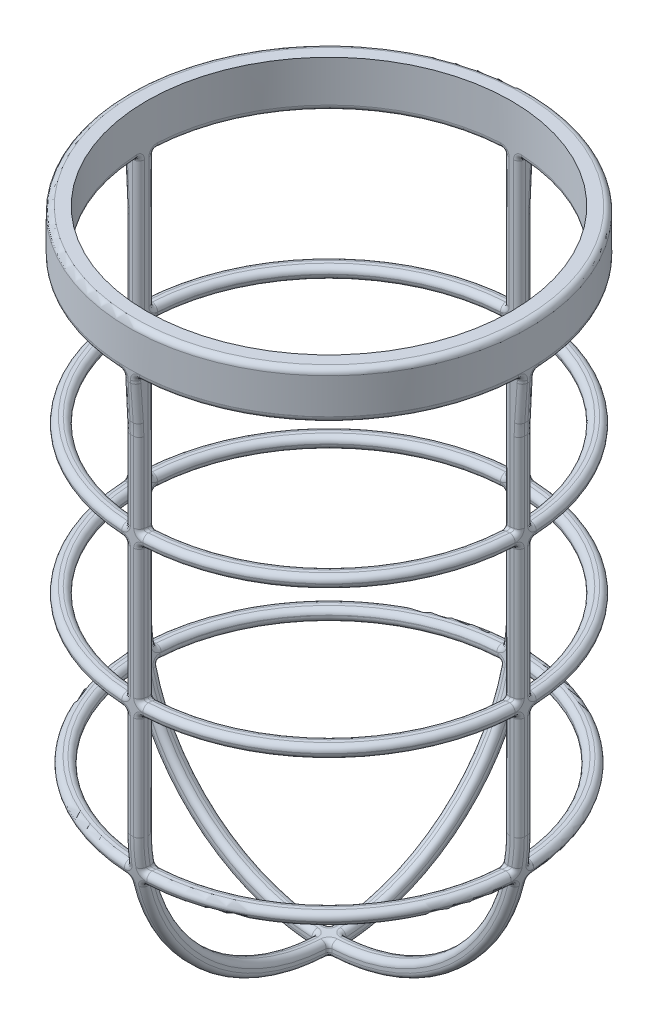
SolidWorks part; units mm, degrees
ref_plane "Front" through (0, 0, 0) normal (0, 0, 1) x (1, 0, 0)
ref_plane "Top" through (0, 0, 0) normal (0, 1, 0) x (1, 0, 0)
ref_plane "Right" through (0, 0, 0) normal (1, 0, 0) x (0, 0, -1)
sketch "Sketch1" plane through (0, 0, 0) normal (0, 0, 1) x (1, 0, 0)
  line L0 (-49.2125, -63.5) -> (-49.2125, -184.15)
  line L1 (0, -233.3625) -> (18.9057, -233.3625) construction
  line L2 (0, 0) -> (0, -237.3312) construction
  line L3 (-49.2125, -63.5) -> (-49.2125, -76.2) construction
  line L4 (-49.2125, -63.5) -> (-53.975, -63.5)
  line L5 (49.2125, -63.5) -> (-49.2125, -63.5) construction
  line L6 (-53.975, -63.5) -> (-53.975, -76.2)
  line L7 (-53.975, -76.2) -> (-53.1812, -88.9)
  line L8 (-53.1812, -88.9) -> (-53.1812, -184.15)
  line L9 (0, -237.3312) -> (18.9057, -237.3312) construction
  line L10 (-49.2125, -76.2) -> (49.2125, -76.2) construction
  line L11 (0, -233.3625) -> (0, -237.3312)
  arc A0 (-49.2125, -184.15) -> (0, -233.3625) centre (0, -184.15) ccw
  arc A1 (-46.0375, -184.15) -> (46.0375, -184.15) centre (0, -184.15) ccw construction
  arc A2 (-53.1812, -184.15) -> (0, -237.3312) centre (0, -184.15) ccw
  dimension "D1" = 3.9688
  dimension "D2" = 4.7625
  dimension "D3" = 12.7
revolve "Revolve1" add sketch "Sketch1" angle 360 about L2
ref_plane "Plane1" through (0, -76.2, 0) normal (0, 1, 0) x (-1, 0, 0)
fillet "Fillet1" radius 50.8 2 edges at (-53.1812, -88.9, 0) (-53.975, -76.2, 0)
sketch "Sketch2" plane through (0, -76.2, 0) normal (0, 1, 0) x (-1, 0, 0)
  line L0 (0, 0) -> (63.5, 0) construction
  line L1 (0, 0) -> (0, -63.5) construction
  line L2 (1.5875, 53.9516) -> (6.2041, 27.7696)
  line L3 (6.2041, 27.7696) -> (1.5875, 1.5875)
  line L4 (1.5875, 1.5875) -> (27.7696, 6.2041)
  line L5 (27.7696, 6.2041) -> (53.9516, 1.5875)
  line L6 (-1.5875, -53.9516) -> (-6.2041, -27.7696)
  line L7 (-1.5875, 53.9516) -> (-6.2041, 27.7696)
  line L8 (-6.2041, 27.7696) -> (-1.5875, 1.5875)
  line L9 (-27.7696, -6.2041) -> (-53.9516, -1.5875)
  line L10 (1.5875, -53.9516) -> (6.2041, -27.7696)
  line L11 (6.2041, -27.7696) -> (1.5875, -1.5875)
  line L12 (1.5875, -1.5875) -> (27.7696, -6.2041)
  line L13 (27.7696, -6.2041) -> (53.9516, -1.5875)
  line L14 (-1.5875, -1.5875) -> (-27.7696, -6.2041)
  line L15 (-6.2041, -27.7696) -> (-1.5875, -1.5875)
  line L16 (-27.7696, 6.2041) -> (-53.9516, 1.5875)
  line L17 (-1.5875, 1.5875) -> (-27.7696, 6.2041)
  circle A0 centre (0, 0) radius 53.975 construction
  arc A1 (1.5875, -53.9516) -> (53.9516, -1.5875) centre (0, 0) ccw
  arc A2 (1.5875, 53.9516) -> (53.9516, 1.5875) centre (0, 0) cw
  arc A3 (-1.5875, 53.9516) -> (-53.9516, 1.5875) centre (0, 0) ccw
  arc A4 (-1.5875, -53.9516) -> (-53.9516, -1.5875) centre (0, 0) cw
  dimension "D1" = 3.175
  dimension "D2" = 10
extrude "Cut-Extrude1" cut sketch "Sketch2" against normal blind 36.5125
pattern_linear "LPattern1" count 4 spacing 39.6875 along (0, -1, 0) of "Cut-Extrude1"
sketch "Sketch3" plane through (0, -195.2625, 0) normal (0, -1, 0) x (1, 0, 0)
  line L0 (-1.9367, 51.9712) -> (-1.9367, 1.9367)
  line L1 (-51.9712, 1.9367) -> (-1.9367, 1.9367)
  line L4 (-1.9367, -51.9712) -> (-1.9367, -1.9367)
  line L5 (-1.9367, -1.9367) -> (-51.9712, -1.9367)
  line L8 (1.9367, 51.9712) -> (1.9367, 1.9367)
  line L9 (1.9367, 1.9367) -> (51.9712, 1.9367)
  line L12 (51.9712, -1.9367) -> (1.9367, -1.9367)
  line L13 (1.9367, -1.9367) -> (1.9367, -51.9712)
  arc A0 (-1.9367, 51.9712) -> (-51.9712, 1.9367) centre (0, 0) ccw construction
  arc A1 (-1.9367, 51.9712) -> (-51.9712, 1.9367) centre (0, 0) ccw
  arc A2 (51.9712, 1.9367) -> (1.9367, 51.9712) centre (0, 0) ccw construction
  arc A3 (51.9712, 1.9367) -> (1.9367, 51.9712) centre (0, 0) ccw
  arc A4 (1.9367, -51.9712) -> (51.9712, -1.9367) centre (0, 0) ccw construction
  arc A5 (1.9367, -51.9712) -> (51.9712, -1.9367) centre (0, 0) ccw
  arc A6 (-51.9712, -1.9367) -> (-1.9367, -51.9712) centre (0, 0) ccw construction
  arc A7 (-51.9712, -1.9367) -> (-1.9367, -51.9712) centre (0, 0) ccw
extrude "Cut-Extrude2" cut sketch "Sketch3" along normal through all
fillet "Fillet2" radius 0.762 64 edges at (51.1527, -112.7125, -2.081) (2.081, -112.7125, -51.1527) (2.0128, -76.2, -51.5395) (51.5395, -76.2, -2.0128) (-2.081, -152.4, -51.1527) (-51.1527, -152.4, -2.081) (-2.081, -115.8875, -51.1527) (-51.1527, -115.8875, -2.081) (-51.1527, -152.4, 2.081) (-2.081, -152.4, 51.1527) (-2.081, -115.8875, 51.1527) (-51.1527, -115.8875, 2.081) (2.081, -152.4, 51.1527) (51.1527, -152.4, 2.081) (2.081, -115.8875, 51.1527) (51.1527, -115.8875, 2.081) (51.1527, -152.4, -2.081) (2.081, -152.4, -51.1527) (2.081, -115.8875, -51.1527) (51.1527, -115.8875, -2.081) (-2.1913, -192.0875, -50.5274) (-50.5274, -192.0875, -2.1913) (-2.081, -155.575, -51.1527) (-51.1527, -155.575, -2.081) (-50.5274, -192.0875, 2.1913) (-2.1913, -192.0875, 50.5274) (-2.081, -155.575, 51.1527) (-51.1527, -155.575, 2.081) (2.1913, -192.0875, 50.5274) (50.5274, -192.0875, 2.1913) (2.081, -155.575, 51.1527) (51.1527, -155.575, 2.081) (50.5274, -192.0875, -2.1913) (2.1913, -192.0875, -50.5274) (2.081, -155.575, -51.1527) (-2.081, -112.7125, -51.1527) (51.1527, -155.575, -2.081) (-51.1527, -112.7125, -2.081) (-2.0128, -76.2, -51.5395) (-51.5395, -76.2, -2.0128) (-49.9368, -195.2625, 1.9367) (-1.9367, -195.2625, 49.9368) (-1.9367, -235.2734, 1.9367) (-49.9368, -195.2625, -1.9367) (-1.9367, -235.2734, -1.9367) (-1.9367, -195.2625, -49.9368) (1.9367, -195.2625, 49.9368) (49.9368, -195.2625, 1.9367) (1.9367, -235.2734, 1.9367) (49.9368, -195.2625, -1.9367) (1.9367, -195.2625, -49.9368) (1.9367, -235.2734, -1.9367) (-51.1527, -112.7125, 2.081) (-2.081, -112.7125, 51.1527) (-2.0128, -76.2, 51.5395) (-51.5395, -76.2, 2.0128) (2.081, -112.7125, 51.1527) (51.1527, -112.7125, 2.081) (2.0128, -76.2, 51.5395) (51.5395, -76.2, 2.0128)
fillet "Fillet3" radius 1.524 281 edges at (53.1532, -101.2182, -1.7283) (-49.0193, -187.7479, -2.4572) (-1.7499, -187.7463, -53.0306) (-2.4338, -170.2435, -49.1523) (-53.1532, -170.2435, -1.7283) (-2.4572, -187.7479, 49.0193) (-53.0306, -187.7463, 1.7499) (-49.1523, -170.2435, 2.4338) (-1.7283, -170.2435, 53.1532) (49.0193, -187.7479, 2.4572) (1.7499, -187.7463, 53.0306) (2.4338, -170.2435, 49.1523) (53.1532, -170.2435, 1.7283) (-1.7283, -101.2182, -53.1532) (2.4572, -187.7479, -49.0193) (53.0306, -187.7463, -1.7499) (49.1523, -170.2435, -2.4338) (1.7283, -170.2435, -53.1532) (-31.3357, -222.0471, 1.9367) (-34.1616, -224.8622, 1.9367) (-1.9367, -222.0471, 31.3357) (-1.9367, -224.8622, 34.1616) (-1.9367, -222.0471, -31.3357) (-1.9367, -224.8622, -34.1616) (-31.3357, -222.0471, -1.9367) (-34.1616, -224.8622, -1.9367) (1.9367, -222.0471, 31.3357) (1.9367, -224.8622, 34.1616) (31.3357, -222.0471, 1.9367) (34.1616, -224.8622, 1.9367) (31.3357, -222.0471, -1.9367) (34.1616, -224.8622, -1.9367) (1.9367, -222.0471, -31.3357) (1.9367, -224.8622, -34.1616) (34.3429, -192.0875, 34.3429) (37.1836, -192.0875, 37.1836) (49.1523, -170.2435, 2.4338) (53.0306, -187.7463, 1.7499) (37.1836, -192.0875, -37.1836) (34.3429, -192.0875, -34.3429) (53.1532, -170.2435, -1.7283) (49.0193, -187.7479, -2.4572) (36.7747, -195.2625, 36.7747) (33.8997, -195.2625, 33.8997) (36.7747, -195.2625, -36.7747) (33.8997, -195.2625, -33.8997) (-34.3429, -192.0875, -34.3429) (-37.1836, -192.0875, -37.1836) (-1.7283, -170.2435, -53.1532) (-2.4572, -187.7479, -49.0193) (2.4338, -170.2435, -49.1523) (1.7499, -187.7463, -53.0306) (-36.7747, -195.2625, -36.7747) (-33.8997, -195.2625, -33.8997) (-49.1523, -170.2435, -2.4338) (-53.0306, -187.7463, -1.7499) (-37.1836, -192.0875, 37.1836) (-34.3429, -192.0875, 34.3429) (-53.1532, -170.2435, 1.7283) (-49.0193, -187.7479, 2.4572) (-36.7747, -195.2625, 36.7747) (-33.8997, -195.2625, 33.8997) (-2.4338, -170.2435, 49.1523) (-1.7499, -187.7463, 53.0306) (1.7283, -170.2435, 53.1532) (2.4572, -187.7479, 49.0193) (37.6048, -152.4, 37.6048) (34.7985, -152.4, 34.7985) (49.1523, -134.1438, 2.4338) (53.1532, -134.1438, 1.7283) (34.7985, -152.4, -34.7985) (37.6048, -152.4, -37.6048) (49.1523, -134.1438, -2.4338) (53.1532, -134.1438, -1.7283) (34.7985, -155.575, 34.7985) (37.6048, -155.575, 37.6048) (37.6048, -155.575, -37.6048) (-53.1532, -101.2182, 1.7283) (34.7985, -155.575, -34.7985) (-37.6048, -152.4, -37.6048) (-34.7985, -152.4, -34.7985) (-2.4338, -134.1438, -49.1523) (-1.7283, -134.1438, -53.1532) (2.4338, -134.1438, -49.1523) (1.7283, -134.1438, -53.1532) (-34.7985, -155.575, -34.7985) (-37.6048, -155.575, -37.6048) (-49.1523, -134.1438, -2.4338) (-53.1532, -134.1438, -1.7283) (-34.7985, -152.4, 34.7985) (-37.6048, -152.4, 37.6048) (-49.1523, -134.1438, 2.4338) (-53.1532, -134.1438, 1.7283) (-37.6048, -155.575, 37.6048) (-34.7985, -155.575, 34.7985) (-2.4338, -134.1438, 49.1523) (-1.7283, -134.1438, 53.1532) (2.4338, -134.1438, 49.1523) (1.7283, -134.1438, 53.1532) (37.6048, -112.7125, 37.6048) (34.7985, -112.7125, 34.7985) (49.1523, -94.4562, 2.4338) (53.1532, -101.2182, 1.7283) (34.7985, -112.7125, -34.7985) (37.6048, -112.7125, -37.6048) (49.1523, -94.4562, -2.4338) (34.7985, -115.8875, 34.7985) (37.6048, -115.8875, 37.6048) (37.6048, -115.8875, -37.6048) (34.7985, -115.8875, -34.7985) (-34.7985, -112.7125, -34.7985) (-37.6048, -112.7125, -37.6048) (-2.4338, -94.4562, -49.1523) (2.4338, -94.4562, -49.1523) (1.7283, -101.2182, -53.1532) (-34.7985, -115.8875, -34.7985) (-37.6048, -115.8875, -37.6048) (-49.1523, -94.4562, -2.4338) (-53.1532, -101.2182, -1.7283) (-34.7985, -112.7125, 34.7985) (-37.6048, -112.7125, 37.6048) (-49.1523, -94.4562, 2.4338) (-37.6048, -115.8875, 37.6048) (-34.7985, -115.8875, 34.7985) (-2.4338, -94.4562, 49.1523) (-1.7283, -101.2182, 53.1532) (2.4338, -94.4562, 49.1523) (34.7985, -76.2, 34.7985) (38.1486, -76.2, 38.1486) (38.1486, -76.2, -38.1486) (34.7985, -76.2, -34.7985) (-34.7985, -76.2, -34.7985) (-38.1486, -76.2, -38.1486) (-38.1486, -76.2, 38.1486) (-34.7985, -76.2, 34.7985) (-2.2232, -233.2672, 2.1033) (-2.1033, -237.2431, 2.2231) (-2.1033, -233.2672, -2.2232) (-2.2231, -237.2431, -2.1033) (2.1033, -233.2672, 2.2232) (2.2231, -237.2431, 2.1033) (2.2232, -233.2672, -2.1033) (2.1033, -237.2431, -2.2231) (48.5147, -191.9103, 2.8238) (52.5901, -191.801, 1.9967) (52.5694, -191.9118, -2.1108) (48.5385, -191.8009, -2.711) (51.9251, -195.4213, 2.2331) (47.8297, -195.5401, 2.1105) (47.8525, -195.4199, -2.2349) (51.9041, -195.5414, -2.1094) (-2.1108, -191.9118, -52.5694) (-2.711, -191.8009, -48.5385) (2.8238, -191.9103, -48.5147) (1.9967, -191.801, -52.5901) (-2.2349, -195.4199, -47.8525) (-2.1094, -195.5414, -51.9041) (2.2331, -195.4213, -51.9251) (2.1105, -195.5401, -47.8297) (-48.5147, -191.9103, -2.8238) (-52.5901, -191.801, -1.9967) (-52.5694, -191.9118, 2.1108) (-48.5385, -191.8009, 2.711) (-47.8525, -195.4199, 2.2349) (-51.9041, -195.5414, 2.1094) (-51.9251, -195.4213, -2.2331) (-47.8297, -195.5401, -2.1105) (-2.8238, -191.9103, 48.5147) (-1.9967, -191.801, 52.5901) (2.1108, -191.9118, 52.5694) (2.711, -191.8009, 48.5385) (-2.2331, -195.4213, 51.9251) (-2.1105, -195.5401, 47.8297) (2.2349, -195.4199, 47.8525) (2.1094, -195.5414, 51.9041) (49.1375, -152.2248, 2.7165) (53.1476, -152.1062, 1.8926) (53.1432, -152.226, -2.0117) (49.1439, -152.1049, -2.5975) (49.1439, -155.8701, 2.5975) (53.1432, -155.749, 2.0117) (53.1476, -155.8688, -1.8926) (49.1375, -155.7502, -2.7165) (-2.0117, -152.226, -53.1432) (-2.5975, -152.1049, -49.1439) (2.7165, -152.2248, -49.1375) (1.8926, -152.1062, -53.1476) (-1.8926, -155.8688, -53.1476) (-2.7165, -155.7502, -49.1375) (2.5975, -155.8701, -49.1439) (2.0117, -155.749, -53.1432) (-49.1375, -152.2248, -2.7165) (-53.1476, -152.1062, -1.8926) (-53.1432, -152.226, 2.0117) (-49.1439, -152.1049, 2.5975) (-49.1439, -155.8701, -2.5975) (-53.1432, -155.749, -2.0117) (-53.1476, -155.8688, 1.8926) (-49.1375, -155.7502, 2.7165) (-2.7165, -152.2248, 49.1375) (-1.8926, -152.1062, 53.1476) (2.0117, -152.226, 53.1432) (2.5975, -152.1049, 49.1439) (-2.5975, -155.8701, 49.1439) (-2.0117, -155.749, 53.1432) (1.8926, -155.8688, 53.1476) (2.7165, -155.7502, 49.1375) (49.1375, -112.5373, 2.7165) (53.1476, -112.4187, 1.8926) (53.1432, -112.5385, -2.0117) (49.1439, -112.4174, -2.5975) (49.1439, -116.1826, 2.5975) (53.1432, -116.0615, 2.0117) (53.1476, -116.1813, -1.8926) (49.1375, -116.0627, -2.7165) (-2.0117, -112.5385, -53.1432) (-2.5975, -112.4174, -49.1439) (2.7165, -112.5373, -49.1375) (1.8926, -112.4187, -53.1476) (-1.8926, -116.1813, -53.1476) (-2.7165, -116.0627, -49.1375) (2.5975, -116.1826, -49.1439) (2.0117, -116.0615, -53.1432) (-49.1375, -112.5373, -2.7165) (-53.1476, -112.4187, -1.8926) (-53.1432, -112.5385, 2.0117) (-49.1439, -112.4174, 2.5975) (-49.1439, -116.1826, -2.5975) (-53.1432, -116.0615, -2.0117) (-53.1476, -116.1813, 1.8926) (-49.1375, -116.0627, 2.7165) (-2.7165, -112.5373, 49.1375) (-1.8926, -112.4187, 53.1476) (2.0117, -112.5385, 53.1432) (2.5975, -112.4174, 49.1439) (-2.5975, -116.1826, 49.1439) (-2.0117, -116.0615, 53.1432) (1.8926, -116.1813, 53.1476) (2.7165, -116.0627, 49.1375) (49.1439, -76.4951, 2.5975) (53.9119, -76.3725, 1.878) (53.9115, -76.4958, -1.7563) (49.1375, -76.3752, -2.7165) (2.5975, -76.4951, -49.1439) (1.878, -76.3725, -53.9119) (-1.7563, -76.4958, -53.9115) (-2.7165, -76.3752, -49.1375) (-49.1439, -76.4951, -2.5975) (-53.9119, -76.3725, -1.878) (-53.9115, -76.4958, 1.7563) (-49.1375, -76.3752, 2.7165) (1.7563, -76.4958, 53.9115) (2.7165, -76.3752, 49.1375) (-2.5975, -76.4951, 49.1439) (-1.878, -76.3725, 53.9119) (-53.975, -63.5, 0) (1.7283, -101.2182, 53.1532)
